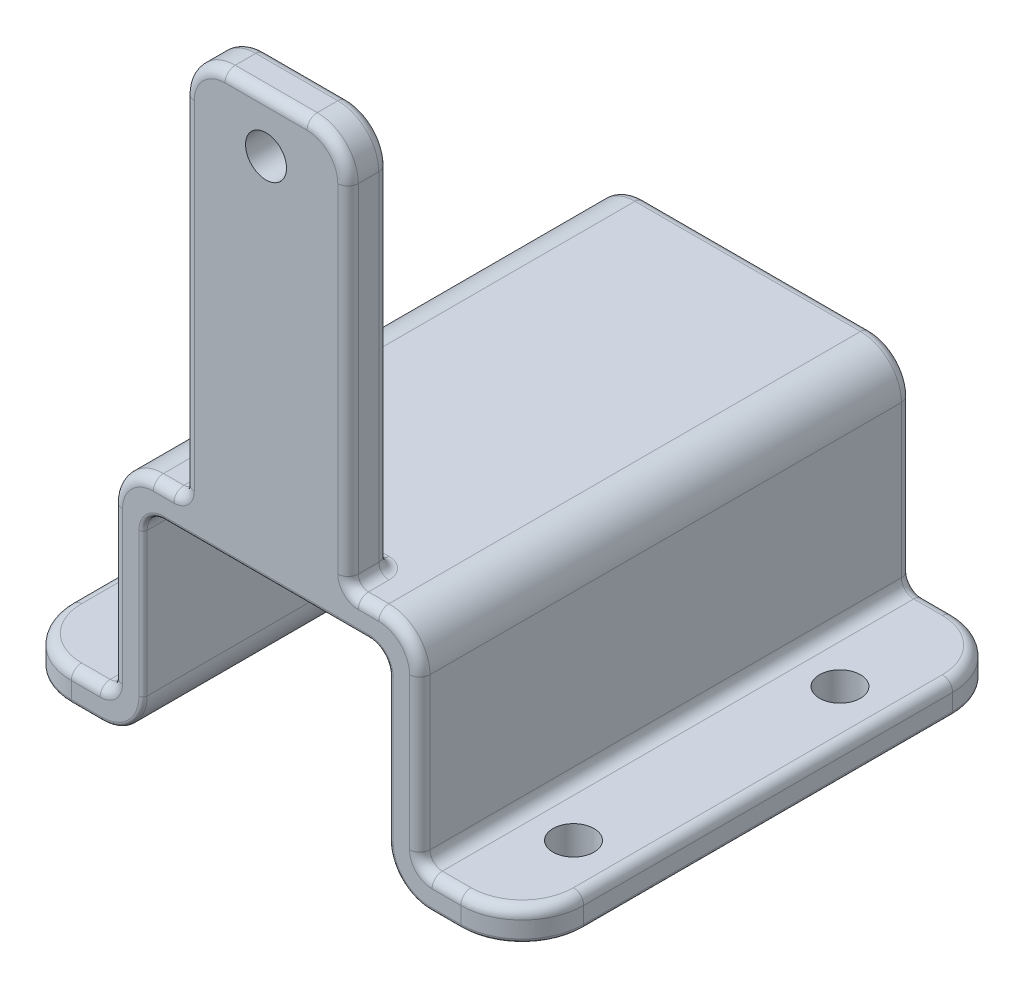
SolidWorks part; units mm, degrees
ref_plane "前视基准面" through (0, 0, 0) normal (0, 0, 1) x (1, 0, 0)
ref_plane "上视基准面" through (0, 0, 0) normal (0, 1, 0) x (1, 0, 0)
ref_plane "右视基准面" through (0, 0, 0) normal (1, 0, 0) x (0, 0, -1)
sketch "草图1" plane through (0, 0, 0) normal (0, 0, 1) x (1, 0, 0)
  line L0 (-12.5, 0) -> (-6, 0)
  line L1 (-12.5, 1.5) -> (-12.5, 0)
  line L2 (12.5, 1.5) -> (12.5, 0)
  line L3 (-12.5, 1.5) -> (-7.5, 1.5)
  line L4 (-7.5, 1.5) -> (-7.5, 11.5)
  line L5 (-6, 0) -> (-6, 10)
  line L6 (6, 0) -> (12.5, 0)
  line L7 (6, 0) -> (6, 10)
  line L8 (-6, 10) -> (6, 10)
  line L9 (7.5, 11.5) -> (-7.5, 11.5)
  line L10 (7.5, 11.5) -> (7.5, 1.5)
  line L11 (7.5, 1.5) -> (12.5, 1.5)
  point P4 (0, 0)
  point P11 (0, 0)
extrude "凸台-拉伸1" add sketch "草图1" along normal blind 24
fillet "圆角1" radius 2 2 edges at (6, 0, 12) (-6, 0, 12)
fillet "圆角2" radius 2 2 edges at (-7.5, 11.5, 12) (7.5, 11.5, 12)
fillet "圆角3" radius 3 4 edges at (12.5, 0.75, 24) (12.5, 0.75, 0) (-12.5, 0.75, 24) (-12.5, 0.75, 0)
fillet "圆角4" radius 1 2 edges at (-6, 10, 12) (6, 10, 12)
fillet "圆角5" radius 0.6 2 edges at (-7.5, 1.5, 12) (7.5, 1.5, 12)
sketch "草图2" plane through (0, 1.5, 0) normal (0, 1, 0) x (1, 0, 0)
  line L0 (12.5, -12) -> (-12.5, -12) construction
  line L7 (12.5, -21) -> (12.5, -3) construction
  line L8 (-12.5, -21) -> (-12.5, -3) construction
  line L9 (0, -24.425) -> (0, -0.4508) construction
  circle A0 centre (-10, -6) radius 1
  circle A1 centre (10, -19) radius 1
  circle A3 centre (-10, -19) radius 1
  circle A4 centre (10, -6) radius 1
  dimension "D1" = 2.5
  dimension "D2" = 2.5
  dimension "D3" = 2.5
  dimension "D4" = 2.5
extrude "切除-拉伸1" cut sketch "草图2" against normal blind 10
sketch "草图3" plane through (0, 11.5, 0) normal (0, 1, 0) x (1, 0, 0)
  line L1 (0, 0) -> (0, -24) construction
  line L2 (5.5, 0) -> (-5.5, 0) construction
  line L3 (5.5, -24) -> (-5.5, -24) construction
  line L5 (4, -22) -> (-4, -22)
  line L6 (4, -22) -> (4, -24)
  line L7 (4, -24) -> (-4, -24)
  line L8 (-4, -22) -> (-4, -24)
  line L9 (4, -22) -> (-4, -24) construction
  line L10 (4, -24) -> (-4, -22) construction
  point P10 (0, -23)
extrude "凸台-拉伸2" add sketch "草图3" along normal blind 19
sketch "草图4" plane through (0, 0, 24) normal (0, 0, 1) x (1, 0, 0)
  line L0 (-4, 30.5) -> (4, 30.5) construction
  circle A0 centre (0, 27.9) radius 1
  point P4 (0, 30.5)
  dimension "D1" = 2
  dimension "D2" = 2.6
extrude "切除-拉伸2" cut sketch "草图4" against normal blind 6
fillet "圆角6" radius 2 2 edges at (4, 30.5, 23) (-4, 30.5, 23)
fillet "圆角7" radius 0.5 38 edges at (-4, 11.5, 23) (4, 11.5, 23) (0, 11.5, 22) (-4.75, 11.5, 24) (4.75, 11.5, 24) (3.4142, 29.9142, 24) (-3.4142, 29.9142, 24) (4, 20, 24) (-4, 20, 24) (6.9142, 10.9142, 24) (7.5, 5.8, 24) (8.8, 1.5, 24) (11.6213, 1.5, 23.1213) (12.5, 1.5, 12) (11.6213, 1.5, 0.8787) (8.8, 1.5, 0) (7.5, 5.8, 0) (6.9142, 10.9142, 0) (0, 11.5, 0) (-6.9142, 10.9142, 0) (-7.5, 5.8, 0) (-8.8, 1.5, 0) (-11.6213, 1.5, 0.8787) (-12.5, 1.5, 12) (-11.6213, 1.5, 23.1213) (-8.8, 1.5, 24) (-7.5, 5.8, 24) (-6.9142, 10.9142, 24) (0, 30.5, 24) (-4, 20, 22) (-3.4142, 29.9142, 22) (0, 30.5, 22) (3.4142, 29.9142, 22) (4, 20, 22) (-7.6757, 1.6757, 24) (-7.6757, 1.6757, 0) (7.6757, 1.6757, 0) (7.6757, 1.6757, 24)
fillet "圆角8" radius 0.2 24 edges at (-11.6213, 0, 23.1213) (-8.75, 0, 24) (-6.5858, 0.5858, 24) (-6, 5.5, 24) (-5.7071, 9.7071, 24) (0, 10, 24) (5.7071, 9.7071, 24) (6, 5.5, 24) (6.5858, 0.5858, 24) (8.75, 0, 24) (11.6213, 0, 23.1213) (12.5, 0, 12) (11.6213, 0, 0.8787) (8.75, 0, 0) (6.5858, 0.5858, 0) (6, 5.5, 0) (5.7071, 9.7071, 0) (0, 10, 0) (-5.7071, 9.7071, 0) (-6, 5.5, 0) (-6.5858, 0.5858, 0) (-8.75, 0, 0) (-11.6213, 0, 0.8787) (-12.5, 0, 12)
